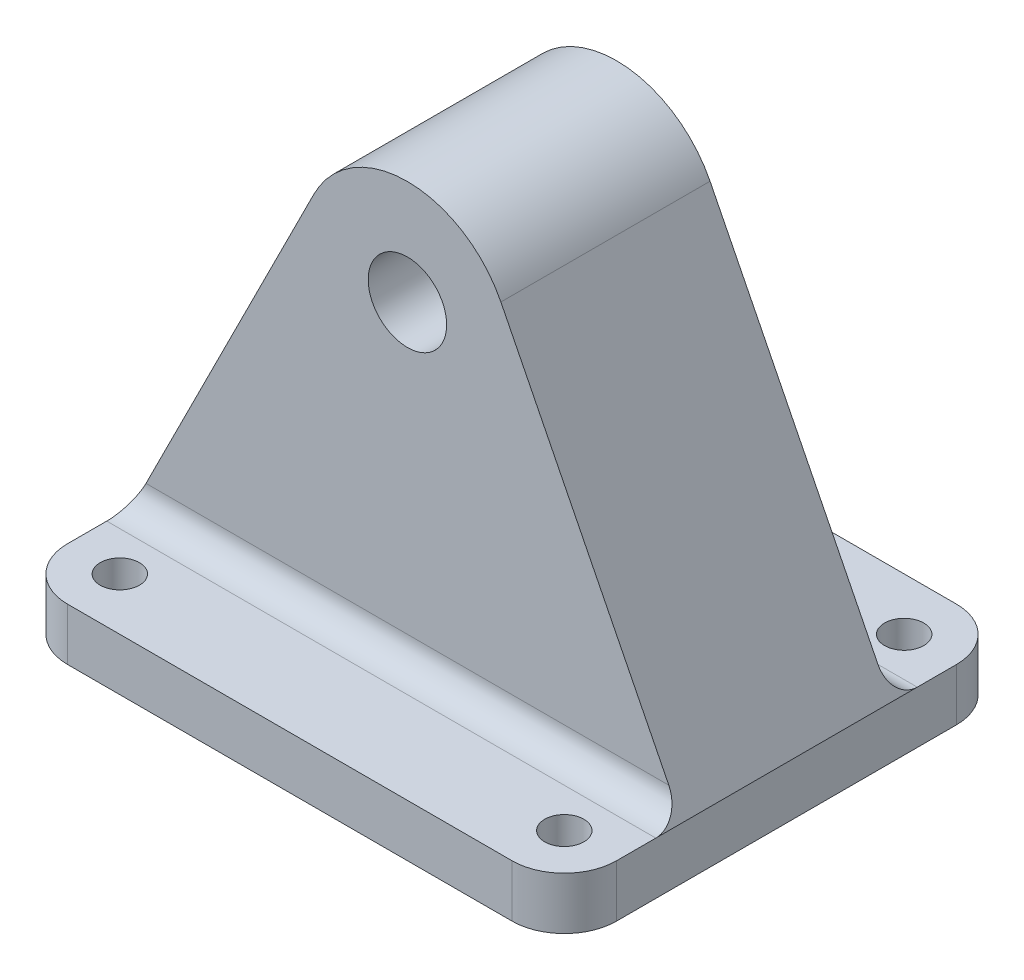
SolidWorks part; units mm, degrees
ref_plane "Front Plane" through (0, 0, 0) normal (0, 0, 1) x (1, 0, 0)
ref_plane "Top Plane" through (0, 0, 0) normal (0, 1, 0) x (1, 0, 0)
ref_plane "Right Plane" through (0, 0, 0) normal (1, 0, 0) x (0, 0, -1)
sketch "Sketch2" plane through (0, 0, 0) normal (0, 1, 0) x (1, 0, 0)
  line L0 (-26.9875, 26.9875) -> (26.9875, 26.9875)
  line L1 (-26.9875, 20.6375) -> (26.9875, 20.6375) construction
  line L2 (-26.9875, 20.6375) -> (-26.9875, -20.6375) construction
  line L3 (-26.9875, -20.6375) -> (26.9875, -20.6375) construction
  line L4 (26.9875, 20.6375) -> (26.9875, -20.6375) construction
  line L5 (-26.9875, 20.6375) -> (26.9875, -20.6375) construction
  line L6 (-26.9875, -20.6375) -> (26.9875, 20.6375) construction
  line L11 (33.3375, 20.6375) -> (33.3375, -20.6375)
  line L12 (-26.9875, -26.9875) -> (26.9875, -26.9875)
  line L13 (-33.3375, 20.6375) -> (-33.3375, -20.6375)
  line L14 (-33.3375, 26.9875) -> (-33.3375, -26.9875) construction
  line L15 (-33.3375, -26.9875) -> (33.3375, -26.9875) construction
  line L16 (33.3375, 26.9875) -> (33.3375, -26.9875) construction
  line L17 (-33.3375, 26.9875) -> (33.3375, 26.9875) construction
  circle A0 centre (-26.9875, 20.6375) radius 2.3813
  circle A1 centre (26.9875, 20.6375) radius 2.3813
  circle A2 centre (26.9875, -20.6375) radius 2.3813
  circle A3 centre (-26.9875, -20.6375) radius 2.3812
  arc A4 (-33.3375, -20.6375) -> (-26.9875, -26.9875) centre (-26.9875, -20.6375) ccw
  arc A5 (26.9875, -26.9875) -> (33.3375, -20.6375) centre (26.9875, -20.6375) ccw
  arc A6 (33.3375, 20.6375) -> (26.9875, 26.9875) centre (26.9875, 20.6375) ccw
  arc A7 (-26.9875, 26.9875) -> (-33.3375, 20.6375) centre (-26.9875, 20.6375) ccw
  point P0 (0, 0)
  point P10 (0, 0)
  dimension "0.5" = 4.7625
  dimension "D1" = 41.275
  dimension "D2" = 53.975
  dimension "D3" = 6.35
extrude "Boss-Extrude1" add sketch "Sketch2" along normal blind 6.35
sketch "Sketch3" plane through (0, 0, 0) normal (0, 0, 1) x (1, 0, 0)
  line L0 (-33.3375, 6.35) -> (-11.35, 50.148)
  line L1 (11.35, 50.148) -> (33.3375, 6.35)
  line L2 (-26.9875, 6.35) -> (26.9875, 6.35) construction
  line L3 (-33.3375, 6.35) -> (33.3375, 6.35)
  arc A0 (11.35, 50.148) -> (-11.35, 50.148) centre (0, 44.45) ccw
  circle A1 centre (0, 44.45) radius 4.7625
  dimension "D1" = 12.7
  dimension "D3" = 9.525
  dimension "D2" = 38.1
extrude "Boss-Extrude2" add sketch "Sketch3" along normal mid plane 25.4
fillet "Fillet1" radius 3.175 2 edges at (0, 6.35, -12.7) (0, 6.35, 12.7)
